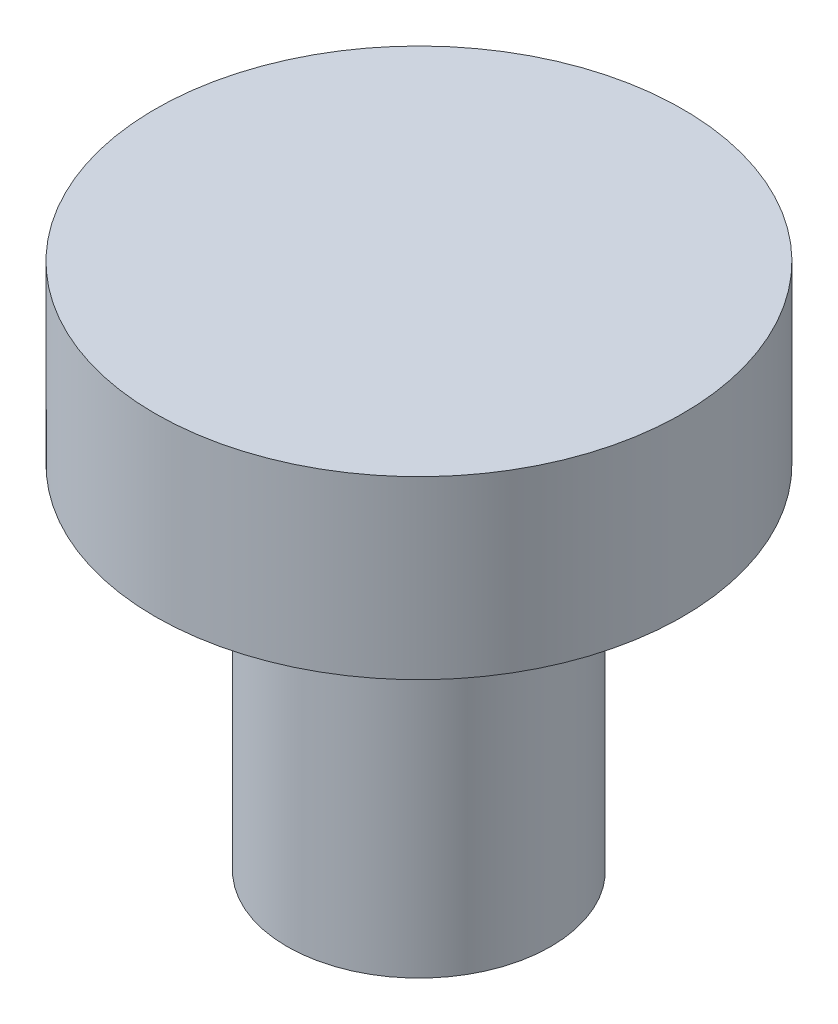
SolidWorks part; units mm, degrees
ref_plane "Front Plane" through (0, 0, 0) normal (0, 0, 1) x (1, 0, 0)
ref_plane "Top Plane" through (0, 0, 0) normal (0, 1, 0) x (1, 0, 0)
ref_plane "Right Plane" through (0, 0, 0) normal (1, 0, 0) x (0, 0, -1)
sketch "Sketch1" plane through (0, 0, 0) normal (0, 1, 0) x (1, 0, 0)
  circle A0 centre (0, 0) radius 7.5
  dimension "D1" = 15
extrude "Boss-Extrude1" add sketch "Sketch1" along normal blind 20
sketch "Sketch2" plane through (0, 20, 0) normal (0, 1, 0) x (1, 0, 0)
  circle A0 centre (0, 0) radius 15
  dimension "D1" = 30
extrude "Boss-Extrude2" add sketch "Sketch2" along normal blind 10
